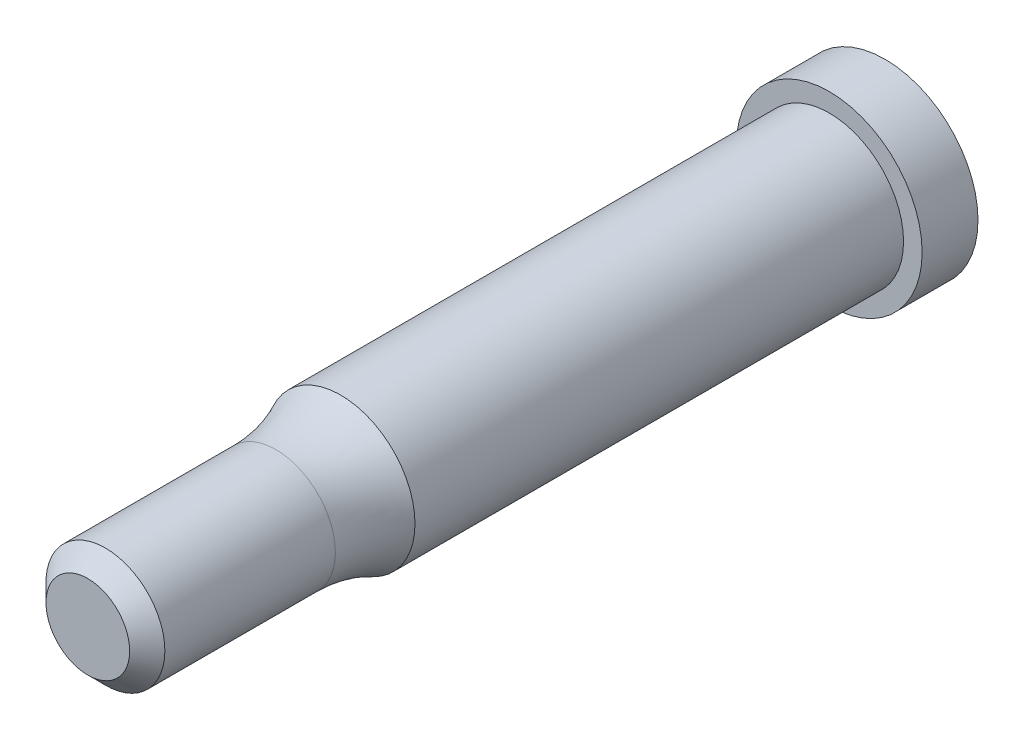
SolidWorks part; units mm, degrees
ref_plane "Front" through (0, 0, 0) normal (0, 0, 1) x (1, 0, 0)
ref_plane "Top" through (0, 0, 0) normal (0, 1, 0) x (1, 0, 0)
ref_plane "Right" through (0, 0, 0) normal (1, 0, 0) x (0, 0, -1)
sketch "Logo3_Revol_Axis" plane through (0, 0, 0) normal (0, 1, 0) x (1, 0, 0)
  line L0 (0, -43.5172) -> (0, 43.5172) construction
sketch "Logo3_bib1" [suppressed] plane through (0, 0, 0) normal (0, -1, 0) x (-1, 0, 0)
  line L0 (5, 0) -> (6.5, 0)
  line L1 (0, 5) -> (0, -95)
  line L2 (0, -43.5172) -> (0, 43.5172) construction
  line L3 (0, 5) -> (6.5, 5)
  line L4 (6.5, 0) -> (6.5, 5)
  line L7 (0, -95) -> (5, -95)
  line L8 (5, 0) -> (5, -95)
  line L10 (0, 16.5468) -> (0, -90.6614) construction
  dimension "logo3_head_l" = 4.7752
  dimension "logo3_l1" = 71.9328
  dimension "logo3_d1" = 12.7
  dimension "logo3_head_d" = 15.875
revolve "Revolve1" [suppressed] add sketch "Logo3_bib1" angle 360 about L10
sketch "logo3_bib2" plane through (0, 0, 0) normal (0, 1, 0) x (1, 0, 0)
  line L0 (0, 0) -> (0, -127.1571) construction
  line L1 (-6.35, 0) -> (-7.9375, 0)
  line L2 (-7.9375, 0) -> (-7.9375, 4.7752)
  line L3 (-7.9375, 4.7752) -> (0, 4.7752)
  line L4 (0, -43.5172) -> (0, 43.5172) construction
  line L5 (-6.35, 0) -> (-6.35, -67.1576) construction
  line L6 (-6.35, -67.1576) -> (0, -67.1576) construction
  line L7 (-5.08, -67.1576) -> (-5.08, -47.2934)
  line L9 (0, -67.1576) -> (-5.08, -67.1576)
  line L10 (-6.35, 0) -> (-6.35, -41.7576)
  line L11 (0, 0) -> (-6.35, 0) construction
  line L12 (0, 4.7752) -> (0, -67.1576)
  arc A0 (-5.08, -47.2934) -> (-6.35, -41.7576) centre (-17.78, -47.2934) ccw
  dimension "logo3_punch_r" = 12.7
  dimension "logo3_d1" = 12.7
  dimension "logo3_punch_d" = 10.16
  dimension "logo3_head_l" = 4.7752
  dimension "logo3_head_d" = 15.875
  dimension "logo3_l1" = 71.9328
  dimension "logo3_punch_l" = 25.4
revolve "Revolve2_Shoulder" add sketch "logo3_bib2" angle 360 about L0
surface "Surface-Offset1" parameters "D1"=0.127
surface "Surface-Extend2" parameters "D1"=0.762
surface "Surface-Extend3" parameters "D1"=5.08
surface "Surface-Plane1"
surface "Surface-Knit1"
other "SurfaceCut1"
delete or keep bodies "Body-Delete/Keep 1" type delete bodies bodies 111
